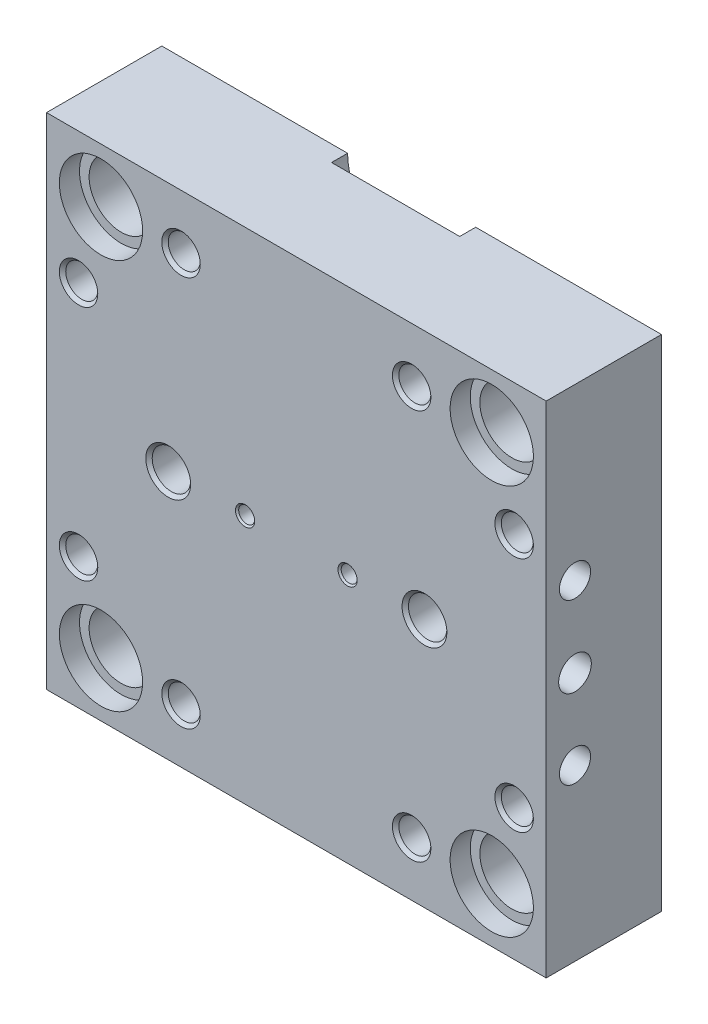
SolidWorks part; units mm, degrees
ref_plane "Plan de face" through (0, 0, 0) normal (0, 0, 1) x (1, 0, 0)
ref_plane "Plan de dessus" through (0, 0, 0) normal (0, 1, 0) x (1, 0, 0)
ref_plane "Plan de droite" through (0, 0, 0) normal (1, 0, 0) x (0, 0, -1)
sketch "Esquisse1" plane through (0, 0, 0) normal (0, 0, 1) x (1, 0, 0)
  line L1 (-78, 78) -> (78, 78)
  line L2 (-78, 78) -> (-78, -78)
  line L3 (-78, -78) -> (78, -78)
  line L4 (78, 78) -> (78, -78)
  point P4 (0, 78)
  point P6 (-78, 0)
  dimension "D1" = 156
  dimension "D2" = 156
extrude "Extrusion1" add sketch "Esquisse1" along normal blind 36
sketch "Esquisse2" plane through (0, 0, 0) normal (0, 0, 1) x (1, 0, 0)
  circle A0 centre (-61, 61) radius 10
  dimension "D1" = 20
  dimension "D3" = 61
  dimension "D2" = 61
extrude "Enlèv. mat.-Extru.2" cut sketch "Esquisse2" along normal through all
sketch "Esquisse3" plane through (0, 0, 36) normal (0, 0, 1) x (1, 0, 0)
  circle A0 centre (-61, 61) radius 13
  dimension "D1" = 26
extrude "Enlèv. mat.-Extru.3" cut sketch "Esquisse3" against normal blind 6.3
hole_wizard "Trou taraudé M10x1.51" positions "Esquisse7" profile "Esquisse6" tap size "M10x1.5" standard "Ansi Métrique"
sketch "Esquisse7" plane through (0, 0, 36) normal (0, 0, 1) x (1, 0, 0)
  point P0 (-36, 61)
  dimension "D1" = 61
  dimension "D2" = 36
sketch "Esquisse6" plane through (-36, 61, 36) normal (1, 0, 0) x (0, -1, 0)
  line L0 (0, 0) -> (0, 22.5537)
  line L1 (0, 22.5537) -> (4.25, 20)
  line L2 (4.25, 20) -> (4.25, 15)
  line L3 (4.25, 15) -> (5, 15)
  line L4 (5, 15) -> (5, 0)
  line L5 (5, 0) -> (0, 0)
  line L10 (0, 22.5537) -> (-4.25, 20) construction
  line L11 (0, -6.35) -> (0, 107.95) construction
  dimension "Diamètre du trou pour taraudage" = 8.5
  dimension "Profondeur du trou pour taraudage" = 20
  dimension "Diamètre principal du filetage" = 10
  dimension "Profondeur du filetage" = 15
  dimension "Angle de pointe" = 118
mirror "Symétrie1" about plane through (0, 0, 0) normal (1, 0, 0) of "Enlèv. mat.-Extru.3", "Enlèv. mat.-Extru.2", "Trou taraudé M10x1.51"
mirror "Symétrie2" about plane through (0, 0, 0) normal (0, 1, 0) of "Symétrie1", "Enlèv. mat.-Extru.2", "Enlèv. mat.-Extru.3", "Trou taraudé M10x1.51"
sketch "Esquisse8" plane through (0, 0, 0) normal (0, 0, -1) x (-1, 0, 0)
  line L0 (0, 0) -> (-19.3743, 0) construction
  line L1 (-22, 2.5) -> (22, 2.5)
  line L3 (-22, -2.5) -> (22, -2.5)
  arc A0 (22, 2.5) -> (22, -2.5) centre (22, 0) cw
  arc A1 (-22, 2.5) -> (-22, -2.5) centre (-22, 0) ccw
  point P4 (0, 2.5)
  dimension "D1" = 44
  dimension "D2" = 5
extrude "canal d'injection" cut sketch "Esquisse8" against normal blind 4
fillet "Congé1" radius 2.5 4 edges at (0, 2.5, 4) (-24.5, 0, 4) (0, -2.5, 4) (24.5, 0, 4)
sketch "Esquisse9" plane through (0, 0, 0) normal (0, 0, -1) x (-1, 0, 0)
  line L0 (-78, 78) -> (78, 78) construction
  line L1 (78, -78) -> (-78, -78) construction
  line L2 (-20, 78) -> (20, 78)
  line L3 (-20, -78) -> (20, -78)
  arc A0 (-20, 78) -> (20, 78) centre (0, 78) ccw
  arc A1 (20, -78) -> (-20, -78) centre (0, -78) ccw
  dimension "D1" = 20
  dimension "D2" = 20
extrude "passage pinces" cut sketch "Esquisse9" against normal blind 5
sketch "Esquisse10" plane through (0, 0, 0) normal (0, 0, -1) x (-1, 0, 0)
  line L0 (-22, 0) -> (22, 0) construction
  line L1 (0, 78) -> (0, -78) construction
  line L2 (20, 78) -> (-20, 78) construction
  line L3 (-20, -78) -> (20, -78) construction
  line L5 (78, 78) -> (78, -78) construction
  line L6 (78, 0) -> (-78, 0) construction
  line L7 (-78, -78) -> (-78, 78) construction
  circle A0 centre (-40, 0) radius 6
  circle A1 centre (-68, 37) radius 5
  circle A4 centre (40, 0) radius 6
  circle A5 centre (68, 37) radius 5
  circle A6 centre (68, -37) radius 5
  circle A7 centre (-68, -37) radius 5
  circle A9 centre (-16, 0) radius 2
  circle A10 centre (16, 0) radius 2
  dimension "D2" = 40
  dimension "D3" = 10
  dimension "D4" = 68
  dimension "D5" = 16
  dimension "D6" = 12
  dimension "D7" = 12
  dimension "D11" = 40
  dimension "D12" = 37
  dimension "D17" = 4
  dimension "D13" = 136
  dimension "D16" = 16
  dimension "D14" = 74
extrude "Enlèv. mat.-Extru.6" cut sketch "Esquisse10" against normal through all
hole_wizard "Trou taraudé M12x1.751" positions "Esquisse16" profile "Esquisse15" tap size "M12x1.75" standard "Ansi Metric"
sketch "Esquisse16" plane through (78, 0, 0) normal (1, 0, 0) x (0, 0, -1)
  line L0 (0, -78) -> (0, 78) construction
  point P0 (-27, 0)
  dimension "D1" = 27
sketch "Esquisse15" plane through (78, 0, 27) normal (0, 1, 0) x (0, 0, -1)
  line L0 (0, 0) -> (0, 28.0644)
  line L1 (0, 28.0644) -> (5.1, 25)
  line L2 (5.1, 25) -> (5.1, 0)
  line L5 (5.1, 0) -> (0, 0)
  line L10 (0, 28.0644) -> (-5.1, 25) construction
  line L11 (0, -6.35) -> (0, 107.95) construction
  dimension "Diamètre du trou pour taraudage" = 10.2
  dimension "Profondeur du trou pour taraudage" = 25
  dimension "Angle de pointe" = 118
hole_wizard "Trou taraudé 1/8 Rc1" positions "Esquisse18" profile "Esquisse17" size "1/8" standard "ISO"
sketch "Esquisse18" plane through (-78, 0, 0) normal (-1, 0, 0) x (0, 0, 1)
  line L0 (0, 78) -> (0, -78) construction
  point P0 (27, 25)
  point P2 (27, -25)
  point P5 (0, 0)
  dimension "D1" = 50
  dimension "D2" = 25
  dimension "D3" = 27
sketch "Esquisse17" plane through (-78, 25, 27) normal (0, 1, 0) x (0, 0, 1)
  line L0 (0, 0) -> (0, 14.3134)
  line L1 (3.95, 11.94) -> (0, 14.3134)
  line L2 (-3.95, 11.94) -> (0, 14.3134) construction
  line L3 (3.95, 11.94) -> (3.95, 7.4)
  line L4 (3.95, 7.4) -> (4.633, 7.4)
  line L5 (4.633, 7.4) -> (4.864, 0)
  line L6 (-4.633, 7.4) -> (-4.864, 0) construction
  line L7 (4.864, 0) -> (0, 0)
  line L8 (0, -6.35) -> (0, 107.95) construction
  line L11 (-3.95, 7.4) -> (-4.633, 7.4) construction
  dimension "Diamètre du trou pour taraudage" = 7.9
  dimension "Profondeur du trou pour taraudage" = 11.94
  dimension "Diamètre du filetage" = 9.728
  dimension "Angle de filetage" = 3.576
  dimension "Profondeur du filetage" = 7.4
  dimension "Angle de pointe" = 118
mirror "Symétrie3" about plane through (0, 0, 0) normal (1, 0, 0) of "Trou taraudé 1/8 Rc1"
sketch "Esquisse19" plane through (-78, 0, 0) normal (-1, 0, 0) x (0, 0, 1)
  circle A0 centre (27, 25) radius 3.5
  circle A1 centre (27, -25) radius 3.5
  dimension "D1" = 7
extrude "Enlèv. mat.-Extru.11" cut sketch "Esquisse19" against normal through all
sketch "Esquisse20" plane through (0, 0, 0) normal (0, 1, 0) x (1, 0, 0)
  line L0 (-16, 0) -> (-16, -42.3966) construction
  line L1 (20, 0) -> (-20, 0) construction
  line L2 (-18, -4) -> (-18, -36) construction
  line L3 (-14, -36) -> (-14, -4) construction
  line L4 (-18.25, 0) -> (-18.5907, -6.5)
  line L5 (-18.5907, -6.5) -> (-16, -6.5)
  line L6 (-16, -6.5) -> (-16, 0)
  line L7 (-16, 0) -> (-18.25, 0)
  line L8 (-18, -4) -> (-22, -4) construction
  dimension "D1" = 4.5
  dimension "D2" = 3
  dimension "D3" = 2.5
revolve "Enlèvement de matière-Révolution1" cut sketch "Esquisse20" angle 360 about L0
mirror "Symétrie5" about plane through (0, 0, 0) normal (1, 0, 0) of "Enlèvement de matière-Révolution1"
chamfer "Chanfrein1" distance 1 angle 45 12 edges at (-18, 0, 36) (14, 0, 36) (-46, 0, 36) (34, 0, 36) (-31, -61, 36) (41, -61, 36) (-31, 61, 36) (41, 61, 36) (63, -37, 36) (-73, -37, 36) (-73, 37, 36) (63, 37, 36)
sketch "Esquisse21" plane through (0, 0, 36) normal (0, 0, 1) x (1, 0, 0)
  circle A0 centre (16, 0) radius 2.5
  circle A1 centre (-16, 0) radius 2.5
  dimension "D1" = 5
extrude "Enlèv. mat.-Extru.12" cut sketch "Esquisse21" against normal blind 20
other "Empreinte1"
other "2019-molette<1>@2019-Moule_complet1"
sketch "Esquisse22" plane through (0, 0, 0) normal (0, 0, -1) x (-1, 0, 0)
  line L0 (-24.5, 0) -> (-40, 0) construction
  line L2 (-29, 1) -> (-23, 1)
  line L3 (-29, 1) -> (-29, -1)
  line L4 (-29, -1) -> (-23, -1)
  line L5 (-23, 1) -> (-23, -1)
  arc A0 (-22, 2.5) -> (-22, -2.5) centre (-22, 0) ccw construction
  dimension "D1" = 2
  dimension "D2" = 6
  dimension "D3" = 1.5
extrude "Enlèv. mat.-Extru.13" cut sketch "Esquisse22" against normal blind 0.6
mirror "Symétrie6" about plane through (0, 0, 0) normal (1, 0, 0) of "Enlèv. mat.-Extru.13", "Empreinte1"
